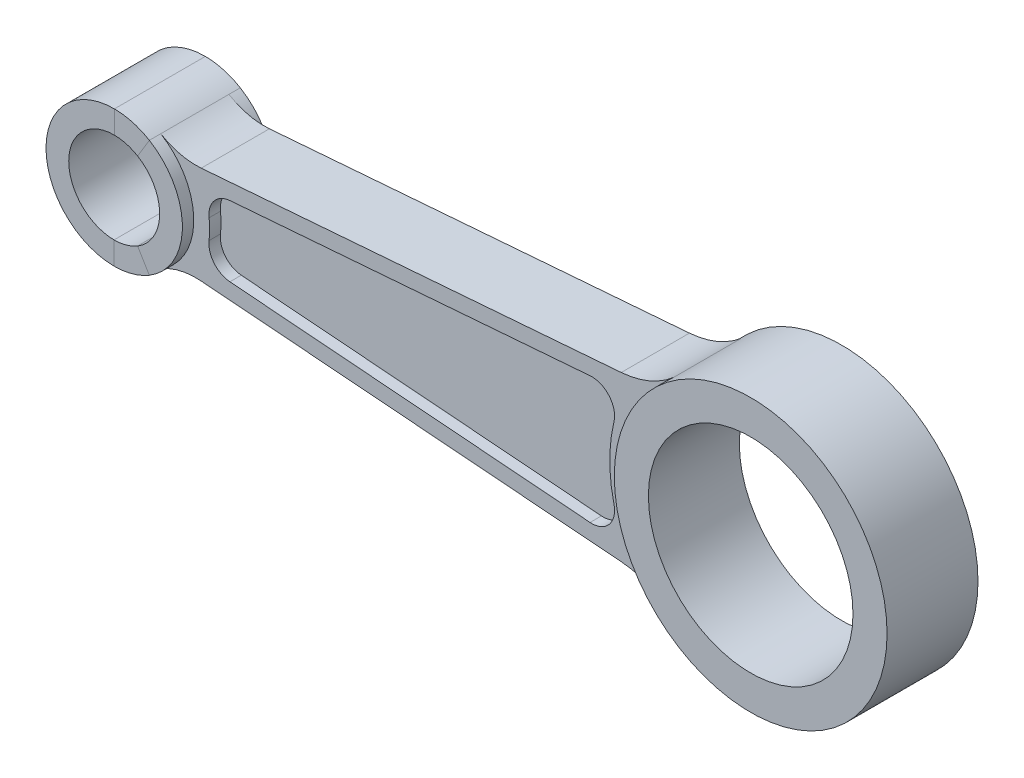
SolidWorks part; units mm, degrees
ref_plane "Front Plane" through (0, 0, 0) normal (0, 0, 1) x (1, 0, 0)
ref_plane "Top Plane" through (0, 0, 0) normal (0, 1, 0) x (1, 0, 0)
ref_plane "Right Plane" through (0, 0, 0) normal (1, 0, 0) x (0, 0, -1)
sketch "Sketch1" plane through (0, 0, 0) normal (0, 1, 0) x (1, 0, 0)
  line L0 (38.1, 25.4) -> (0, 25.4)
  line L1 (0, 25.4) -> (0, 19.05)
  line L2 (0, 19.05) -> (38.1, 19.05)
  line L3 (38.1, 19.05) -> (38.1, 25.4)
  line L4 (0, 25.4) -> (0, 19.05) construction
revolve "Revolve1" add sketch "Sketch1" angle 360 about L4
sketch "Sketch2" plane through (0, 0, -19.05) normal (0, 0, 1) x (1, 0, 0)
  line L0 (295.8347, -47.271) -> (42.2666, -27.3147)
  line L1 (42.2666, 27.3147) -> (295.8347, 47.271)
  arc A0 (295.8347, 47.271) -> (295.8347, -47.271) centre (355.6, 0) cw
  arc A1 (42.2666, -27.3147) -> (19.6386, -32.6486) centre (39.2773, -65.2973) ccw
  arc A2 (19.6386, -32.6486) -> (19.6386, 32.6486) centre (0, 0) cw
  arc A3 (19.6386, 32.6486) -> (42.2666, 27.3147) centre (39.2773, 65.2973) ccw
extrude "Boss-Extrude1" add sketch "Sketch2" along normal blind 44.45
sketch "Sketch3" plane through (0, 0, 25.4) normal (0, 0, 1) x (1, 0, 0)
  line L0 (42.2666, -27.3147) -> (295.8347, -47.271)
  line L1 (295.8347, 47.271) -> (42.2666, 27.3147)
  arc A0 (295.8347, -47.271) -> (295.8347, 47.271) centre (355.6, 0) cw
  arc A1 (42.2666, 27.3147) -> (19.6386, 32.6486) centre (39.2773, 65.2973) cw
  arc A2 (19.6386, 32.6486) -> (19.6386, -32.6486) centre (0, 0) cw
  arc A3 (19.6386, -32.6486) -> (42.2666, -27.3147) centre (39.2773, -65.2973) cw
extrude "Cut-Extrude1" cut sketch "Sketch3" against normal blind 6.35
sketch "Sketch4" plane through (0, 0, -19.05) normal (0, 0, -1) x (-1, 0, 0)
  circle A0 centre (-355.6, 0) radius 76.2
extrude "Boss-Extrude2" add sketch "Sketch4" along normal blind 6.35
sketch "Sketch5" plane through (0, 0, -19.05) normal (0, 0, -1) x (-1, 0, 0)
  line L0 (-43.2073, 18.4713) -> (-259.5169, 35.4952)
  line L1 (-259.5169, -35.4952) -> (-43.2073, -18.4713)
  arc A0 (-43.2073, -18.4713) -> (-43.2073, 18.4713) centre (0, 0) cw
  arc A1 (-259.5169, 35.4952) -> (-272.8622, 19.8689) centre (-260.5133, 22.8344) ccw
  arc A2 (-272.8622, 19.8689) -> (-272.8622, -19.8689) centre (-355.6, 0) cw
  arc A3 (-272.8622, -19.8689) -> (-259.5169, -35.4952) centre (-260.5133, -22.8344) ccw
extrude "Cut-Extrude2" cut sketch "Sketch5" against normal blind 6.35
sketch "Sketch6" plane through (0, 0, 19.05) normal (0, 0, 1) x (1, 0, 0)
  line L0 (259.5169, 35.4952) -> (43.2073, 18.4713)
  line L1 (43.2073, -18.4713) -> (259.5169, -35.4952)
  arc A0 (43.2073, 18.4713) -> (43.2073, -18.4713) centre (0, 0) cw
  arc A1 (259.5169, -35.4952) -> (272.8622, -19.8689) centre (260.5133, -22.8344) ccw
  arc A2 (272.8622, -19.8689) -> (272.8622, 19.8689) centre (355.6, 0) cw
  arc A3 (272.8622, 19.8689) -> (259.5169, 35.4952) centre (260.5133, 22.8344) ccw
extrude "Cut-Extrude3" cut sketch "Sketch6" against normal blind 6.35
hole_wizard "Hole1" positions "Sketch8" profile "Sketch7" legacy
sketch "Sketch8" plane through (0, 0, 25.4) normal (0, 0, 1) x (1, 0, 0)
  point P0 (355.6, 0)
sketch "Sketch7" plane through (355.6, 0, 25.4) normal (1, 0, 0) x (0, -1, 0)
  line L0 (0, 0) -> (0, 50.8)
  line L1 (0, 50.8) -> (57.15, 50.8)
  line L2 (57.15, 50.8) -> (57.15, 0)
  line L3 (57.15, 0) -> (0, 0)
  line L4 (0, 110) -> (0, -10) construction
  dimension "Diameter" = 114.3
  dimension "Depth" = 50.8
hole_wizard "Hole2" positions "Sketch10" profile "Sketch9" legacy
sketch "Sketch10" plane through (0, 0, 25.4) normal (0, 0, 1) x (1, 0, 0)
  point P0 (0, 0)
sketch "Sketch9" plane through (0, 0, 25.4) normal (1, 0, 0) x (0, -1, 0)
  line L0 (0, 0) -> (0, 50.8)
  line L1 (0, 50.8) -> (25.4, 50.8)
  line L2 (25.4, 50.8) -> (25.4, 0)
  line L3 (25.4, 0) -> (0, 0)
  line L4 (0, 110) -> (0, -10) construction
  dimension "Diameter" = 50.8
  dimension "Depth" = 50.8
fillet "Fillet1" radius 12.7 4 edges at (43.2073, 18.4713, 15.875) (43.2073, -18.4713, 15.875) (43.2073, 18.4713, -15.875) (43.2073, -18.4713, -15.875)
fillet "Fillet2" radius 50.8 2 edges at (295.8347, -47.271, 0) (295.8347, 47.271, 0)
sketch "Sketch11" plane through (0, 0, 25.4) normal (0, 0, 1) x (1, 0, 0)
  line L0 (0, 0) -> (0.2425, 70.8754)
  line L1 (0, 0) -> (-0.1925, -56.2477)
  point P0 (0, 0)
sketch "Sketch12" plane through (0, 0, 25.4) normal (0, 0, 1) x (1, 0, 0)
  line L0 (0, 0) -> (26.9831, 44.8586)
  line L1 (0, 0) -> (34.612, -57.5414)
  line L2 (0, 0) -> (0.15, 44.3977) construction
  line L3 (0, 0) -> (-0.203, -60.1108) construction
  arc A0 (42.2666, -27.3147) -> (19.6386, -32.6486) centre (39.2773, -65.2973) ccw construction
  arc A1 (19.6386, 32.6486) -> (42.2666, 27.3147) centre (39.2773, 65.2973) ccw construction
  arc A2 (42.2666, -27.3147) -> (19.6386, -32.6486) centre (39.2773, -65.2973) ccw construction
  arc A3 (19.6386, 32.6486) -> (42.2666, 27.3147) centre (39.2773, 65.2973) ccw construction
  point P0 (0, 0)
sketch "Sketch13" plane through (0, 0, 25.4) normal (0, 0, 1) x (1, 0, 0)
  line L0 (0, 0) -> (481.9131, -2.1347)
  line L1 (0, 0) -> (-73.6281, 0.3262)
  point P0 (0, 0)
